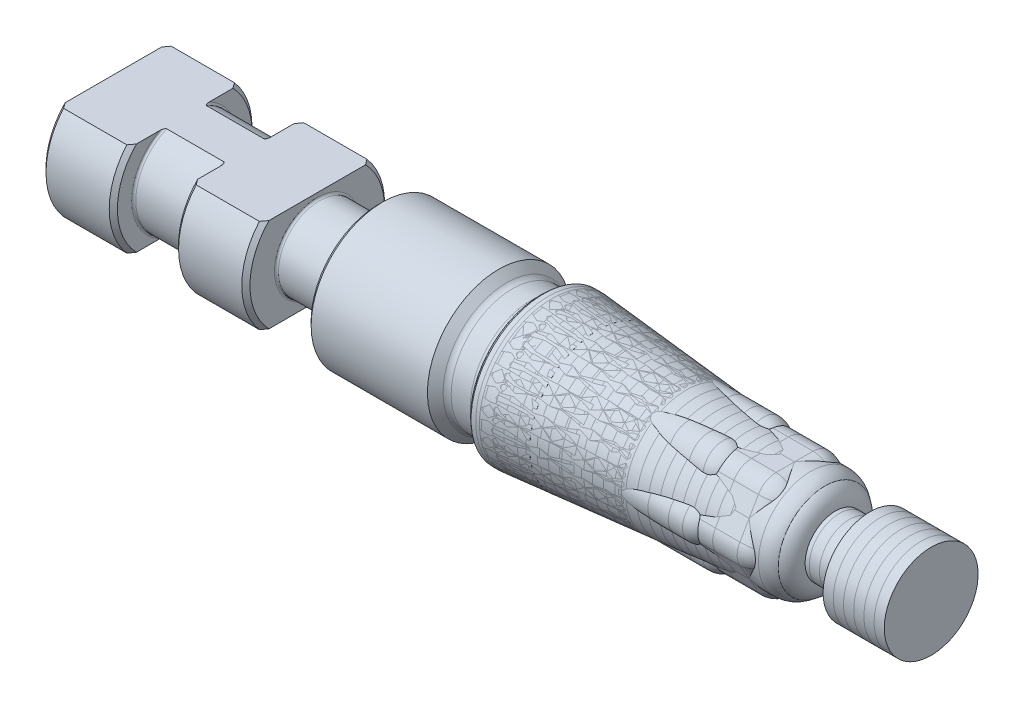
SolidWorks part; units mm, degrees
ref_plane "Front" through (0, 0, 0) normal (0, 0, 1) x (1, 0, 0)
ref_plane "Top" through (0, 0, 0) normal (0, 1, 0) x (1, 0, 0)
ref_plane "Right" through (0, 0, 0) normal (1, 0, 0) x (0, 0, -1)
sketch "Эскиз1" plane through (0, 0, 0) normal (0, 0, 1) x (1, 0, 0)
  line L0 (0, 0) -> (79097.9767, 0) construction
  line L1 (0, 0) -> (0, 1.75)
  line L2 (10.45, 1.65) -> (10.45, 1.5)
  line L3 (9.45, 1.75) -> (9.7, 1.5)
  line L4 (9.7, 1.5) -> (10.45, 1.5)
  line L6 (10.55, 1.75) -> (11.05, 1.75)
  line L7 (11.05, 1.75) -> (17.25, 1.2076)
  line L8 (17.5, 0.9576) -> (17.5, 0)
  line L9 (17.5, 0) -> (0, 0)
  line L10 (17.25, 1.2076) -> (17.5, 0.9576)
  line L11 (17.5, 0.9576) -> (17.5, 1.1857) construction
  line L12 (17.5, 1.1857) -> (17.25, 1.2076) construction
  line L13 (0, 1.75) -> (9.45, 1.75)
  arc A0 (10.55, 1.75) -> (10.45, 1.65) centre (10.55, 1.65) ccw
  dimension "D2" = 17.5
  dimension "D8" = 1
  dimension "D6" = 0.1
  dimension "D5" = 45
  dimension "D3" = 3.5
  dimension "D4" = 7.05
  dimension "D7" = 3
  dimension "D9" = 3.5
  dimension "D11" = 6.45
  dimension "D13" = 5
  dimension "D14" = 45
  dimension "D15" = 0.25
  dimension "D17" = 2.3714
revolve "Повернуть1" add sketch "Эскиз1" angle 360 about L0
sketch "Эскиз8" plane through (0, 0, 0) normal (0, 0, 1) x (1, 0, 0)
  line L0 (0, 0) -> (-50000, 0) construction
  line L2 (17.5, -0.9576) -> (17.5, 0.9576) construction
  line L3 (14.4002, 1.279) -> (14.6, 1.4394)
  line L4 (14.1266, 1.3009) -> (13.95, 1.4963)
  line L5 (13.95, 1.4963) -> (14.6, 1.4394)
  line L6 (17.25, 1.2076) -> (11.05, 1.75) construction
  arc A0 (14.1266, 1.3009) -> (14.4002, 1.279) centre (14.275, 1.435) ccw
  point P3 (14.275, 1.4678)
  point P10 (14.275, 1.235)
  dimension "D4" = 0.2
  dimension "D1" = 2.9
  dimension "D2" = 3.55
  dimension "D3" = 2.47
revolve "Вырез-Повернуть3" cut sketch "Эскиз8" angle 360 about L0
sketch "Эскиз13" plane through (17.5, 0, 0) normal (1, 0, 0) x (0, 0, -1)
  line L1 (-1.4491, 0) -> (-0.7246, -1.255)
  line L2 (-0.7246, -1.255) -> (0.7246, -1.255)
  line L3 (0.7246, -1.255) -> (1.4491, 0)
  line L4 (1.4491, 0) -> (0.7246, 1.255)
  line L5 (0.7246, 1.255) -> (-0.7246, 1.255)
  line L6 (-0.7246, 1.255) -> (-1.4491, 0)
  circle A0 centre (0, 0) radius 1.255 construction
  dimension "D1" = 2.51
extrude "Вырез-Вытянуть1" cut sketch "Эскиз13" against normal blind 3.3 flip side to cut
sketch "Эскиз7" plane through (0, 0, 0) normal (0, 0, 1) x (1, 0, 0)
  line L0 (0, 0) -> (-50000, 0) construction
  line L1 (12.8846, 1.5895) -> (12.9559, 1.4555)
  line L2 (13.95, 1.4963) -> (11.05, 1.75) construction
  line L3 (13.0424, 1.4525) -> (13.1154, 1.5693)
  line L4 (13.95, 1.4963) -> (11.05, 1.75) construction
  line L5 (13.1154, 1.5693) -> (12.8846, 1.5895)
  line L6 (17.5, -0.9576) -> (17.5, 0.9576) construction
  line L7 (11.8846, 1.677) -> (11.9559, 1.543)
  line L8 (12.0424, 1.5399) -> (12.1154, 1.6568)
  line L9 (12.1154, 1.6568) -> (11.8846, 1.677)
  arc A0 (13.0424, 1.4525) -> (12.9559, 1.4555) centre (13, 1.4789) cw
  arc A1 (12.0424, 1.5399) -> (11.9559, 1.543) centre (12, 1.5664) cw
  point P12 (13, 1.5794)
  point P13 (12.9983, 1.429)
  point P23 (12, 1.6669)
  point P24 (11.9983, 1.5165)
  dimension "D1" = 0.05
  dimension "D2" = 60
  dimension "D3" = 0.15
  dimension "D4" = 4.5
  dimension "D6" = 1
  dimension "D5" = 2
revolve "Вырез-Повернуть2" cut sketch "Эскиз7" angle 360 about L0
sketch "Эскиз9" plane through (0, 0, 0) normal (0, 0, 1) x (1, 0, 0)
  line L0 (0, 0) -> (-50000, 0) construction
  line L1 (17.5, 0) -> (17.5, 0.75)
  line L2 (17.5, -0.9576) -> (17.5, 0.9576) construction
  line L3 (17.5, 0.75) -> (17.3, 0.55)
  line L4 (17.3, 0.55) -> (15.5, 0.55)
  line L5 (15.5, 0.55) -> (15.1825, 0)
  line L6 (15.1825, 0) -> (17.5, 0)
  dimension "D1" = 60
  dimension "D2" = 45
  dimension "D3" = 1.5
  dimension "D4" = 1.1
  dimension "D5" = 2
revolve "Вырез-Повернуть4" cut sketch "Эскиз9" angle 360 about L0
fillet "Скругление1" radius 0.2 2 edges at (9.7, 0, 1.5) (10.45, 0, 1.5)
sketch "Эскиз14" plane through (0, 0, 0) normal (0, 0, 1) x (1, 0, 0)
  line L0 (9.45, 1.75) -> (0, 1.75) construction
  line L1 (5, 1.75) -> (6.5, 1.75)
  line L2 (5, 1.75) -> (5, 1)
  line L3 (5, 1) -> (6.5, 1)
  line L4 (6.5, 1.75) -> (6.5, 1)
  line L5 (0, 0) -> (-50000, 0) construction
  line L7 (1.75, 1.75) -> (3.25, 1.75)
  line L8 (1.75, 1.75) -> (1.75, 1.25)
  line L9 (1.75, 1.25) -> (3.25, 1.25)
  line L10 (3.25, 1.75) -> (3.25, 1.25)
  dimension "D1" = 6.5
  dimension "D2" = 1.5
  dimension "D3" = 2
  dimension "D4" = 1.75
  dimension "D5" = 2.5
revolve "Вырез-Повернуть5" cut sketch "Эскиз14" angle 360 about L5
fillet "Скругление2" radius 0.05 4 edges at (1.75, 0, -1.25) (3.25, 0, -1.25) (5, 0, -1) (6.5, 0, -1)
chamfer "Фаска3" distance 0.1 angle 45 5 edges at (0, 0, 1.75) (1.75, 0, -1.75) (3.25, 0, -1.75) (5, 0, -1.75) (6.5, 0, -1.75)
sketch "Эскиз15" plane through (0, 0, 0) normal (0, 0, 1) x (1, 0, 0)
  line L0 (0, 1.65) -> (0, -1.65) construction
  line L1 (0, 1.15) -> (6.5, 1.15)
  line L2 (0, 1.15) -> (0, 1.75)
  line L3 (0, 1.75) -> (6.5, 1.75)
  line L4 (6.5, 1.15) -> (6.5, 1.75)
  line L5 (6.5, 1.65) -> (6.5, -1.65) construction
  line L6 (4.9, 1.75) -> (3.35, 1.75) construction
  line L7 (0, 0) -> (-50000, 0) construction
  line L8 (6.5, -1.15) -> (6.5, -1.75)
  line L9 (0, -1.75) -> (6.5, -1.75)
  line L10 (0, -1.15) -> (0, -1.75)
  line L11 (0, -1.15) -> (6.5, -1.15)
  dimension "D1" = 2.3
extrude "Вырез-Вытянуть2" cut sketch "Эскиз15" against normal through all both and the other way through all
sketch "Эскиз16" plane through (0, 0, 0) normal (0, 0, 1) x (1, 0, 0)
  line L0 (0, 0) -> (-50000, 0) construction
  line L1 (0, 0) -> (0, 1)
  line L2 (0, 1.15) -> (0, -1.15) construction
  line L3 (0, 1) -> (0.2, 0.8)
  line L4 (0.2, 0.8) -> (4.5, 0.8)
  line L5 (4.5, 0.8) -> (4.9619, 0)
  line L6 (4.9619, 0) -> (0, 0)
  dimension "D1" = 60
  dimension "D2" = 1.6
  dimension "D3" = 4.5
  dimension "D4" = 45
  dimension "D5" = 2
revolve "Вырез-Повернуть6" cut sketch "Эскиз16" angle 360 about L0
sketch "Эскиз17" plane through (0, 0, 0) normal (0, 0, 1) x (1, 0, 0)
  line L0 (9.45, 1.75) -> (9.45, -1.75) construction
  point P0 (9.45, 0)
sketch "Эскиз18" plane through (0, 0, 0) normal (0, 0, 1) x (1, 0, 0)
  line L0 (0, 0) -> (-50000, 0) construction
  line L1 (10.55, 1.78) -> (10.6634, 1.78)
  line L2 (10.7506, 1.7762) -> (13.95, 1.4963)
  line L3 (14.4064, 0.9982) -> (14.4064, 0)
  line L4 (14.4064, 0) -> (10.55, 0)
  line L5 (10.55, 1.75) -> (10.55, -1.75) construction
  line L7 (13.95, 1.4963) -> (13.1154, 1.5693) construction
  line L8 (11.05, 1.75) -> (10.55, 1.75) construction
  line L10 (13.95, 1.4963) -> (13.95, -1.4963) construction
  line L11 (10.55, 1.78) -> (10.55, 0)
  arc A0 (13.95, 1.4963) -> (14.4064, 0.9982) centre (13.9064, 0.9982) cw
  arc A1 (10.7506, 1.7762) -> (10.6634, 1.78) centre (10.6634, 0.78) ccw
  dimension "D2" = 0.5
  dimension "D3" = 1
  dimension "D1" = 0.03
  dimension "D4" = 0
revolve "Повернуть2" add sketch "Эскиз18" angle 360 about L0
ref_plane "Плоскость16" through (13.95, 0, 0) normal (1, 0, 0) x (0, 0, -1)
sketch "Эскиз21" plane through (13.95, 0, 0) normal (1, 0, 0) x (0, 0, -1)
  line L0 (-0.7419, 1.285) -> (0.7419, 1.285)
  line L1 (0.7419, 1.285) -> (1.4838, 0)
  line L2 (1.4838, 0) -> (0.7419, -1.285)
  line L3 (0.7419, -1.285) -> (-0.7419, -1.285)
  line L4 (-0.7419, -1.285) -> (-1.4838, 0)
  line L5 (-1.4838, 0) -> (-0.7419, 1.285)
  circle A0 centre (0, 0) radius 1.285 construction
  point P5 (0, 1.285)
  point P18 (0, 0)
  point P35 (0, 0)
  dimension "D2" = 2.57
  dimension "D1" = 6
extrude "Бобышка-Вытянуть1" add sketch "Эскиз21" along normal blind 3.25
fillet "Скругление3" radius 0.5 6 edges at (17.2, -1.285, 0) (17.2, -0.6425, 1.1128) (17.2, 0.6425, 1.1128) (17.2, 1.285, 0) (17.2, 0.6425, -1.1128) (17.2, -0.6425, -1.1128)
fillet "Скругление4" radius 0.5 12 edges at (15.3628, 0, 1.4838) (15.3628, 1.285, 0.7419) (15.3628, 1.285, -0.7419) (15.3628, 0, -1.4838) (15.3628, -1.285, 0.7419) (15.3628, -1.285, -0.7419) (17.0536, 0, 1.3147) (17.0536, 1.1386, 0.6573) (17.0536, 1.1386, -0.6573) (17.0536, 0, -1.3147) (17.0536, -1.1386, 0.6573) (17.0536, -1.1386, -0.6573)
sketch "Эскиз23" plane through (0, 0, 0) normal (0, 0, 1) x (1, 0, 0)
  line L0 (0, 0) -> (-50000, 0) construction
  line L1 (16.7, 1.285) -> (17.1, 1.285)
  line L3 (17.6, 0.785) -> (17.6, 0)
  line L4 (17.6, 0) -> (16.7, 0)
  line L6 (16.7, 0) -> (16.7, 1.285)
  line L7 (17.5, -0.9576) -> (17.5, 0.9576) construction
  arc A0 (17.1, 1.285) -> (17.6, 0.785) centre (17.1, 0.785) cw
  dimension "D1" = 0.5
  dimension "D3" = 0.1
revolve "Повернуть3" add sketch "Эскиз23" angle 360 about L0
sketch "Эскиз25" plane through (0, 0, 0) normal (0, 1, 0) x (1, 0, 0)
  line L0 (0, 0) -> (-50000, 0) construction
  line L1 (13.95, 0.9963) -> (13.95, 1.4963)
  line L2 (13.95, 1.4963) -> (13.95, -1.4963) construction
  line L3 (13.95, 1.4963) -> (15.45, 1.4963)
  line L4 (15.95, 0.9963) -> (13.95, 0.9963)
  line L5 (14.45, 0.9963) -> (50014.45, 0.9963) construction
  arc A0 (15.45, 1.4963) -> (15.95, 0.9963) centre (15.45, 0.9963) cw
  dimension "D1" = 0.5
  dimension "D2" = 1.5
revolve "Повернуть4" add sketch "Эскиз25" angle 360 about L5
pattern_circular "Круговой массив1" count 6 over 360 about axis through (0, 0, 0) along (1, 0, 0) of "Повернуть4"
sketch "Эскиз24" plane through (17.6, 0, 0) normal (1, 0, 0) x (0, 0, -1)
  circle A0 centre (0, 0) radius 0.7
  dimension "D1" = 1.4
ref_plane "Плоскость31" through (17.1, 0, 0) normal (1, 0, 0) x (0, 0, -1)
ref_plane "Плоскость32" through (16.6, 0, 0) normal (1, 0, 0) x (0, 0, -1)
ref_plane "Плоскость33" through (16.1, 0, 0) normal (1, 0, 0) x (0, 0, -1)
ref_plane "Плоскость34" through (15.6, 0, 0) normal (1, 0, 0) x (0, 0, -1)
ref_plane "Плоскость35" through (15.1, 0, 0) normal (1, 0, 0) x (0, 0, -1)
ref_plane "Плоскость36" through (14.6, 0, 0) normal (1, 0, 0) x (0, 0, -1)
ref_plane "Плоскость37" through (14.1, 0, 0) normal (1, 0, 0) x (0, 0, -1)
ref_plane "Плоскость38" through (13.6, 0, 0) normal (1, 0, 0) x (0, 0, -1)
ref_plane "Плоскость39" through (13.1, 0, 0) normal (1, 0, 0) x (0, 0, -1)
ref_plane "Плоскость40" through (12.6, 0, 0) normal (1, 0, 0) x (0, 0, -1)
ref_plane "Плоскость41" through (12.1, 0, 0) normal (1, 0, 0) x (0, 0, -1)
ref_plane "Плоскость42" through (11.6, 0, 0) normal (1, 0, 0) x (0, 0, -1)
ref_plane "Плоскость43" through (11.1, 0, 0) normal (1, 0, 0) x (0, 0, -1)
ref_plane "Плоскость44" through (0, 0, 0) normal (0, 0, 1) x (1, 0, 0)
ref_plane "Плоскость45" through (0, 0, 0) normal (0, 1, 0) x (1, 0, 0)
ref_plane "Плоскость46" through (0, 0, 0) normal (0, -0.866, -0.5) x (-1, 0, 0)
ref_plane "Плоскость47" through (0, 0, 0) normal (0, -0.866, 0.5) x (-1, 0, 0)
sketch "Эскиз26" plane through (0, 0, 0) normal (0, 1, 0) x (1, 0, 0)
  line L0 (0, 0) -> (50000, 0) construction
  line L1 (17.6, 0) -> (17.6, 0.74)
  line L2 (17.6, 0) -> (17.6, 0.785) construction
  line L3 (17.6, 0.74) -> (18.55, 0.74)
  line L4 (18.55, 0.74) -> (18.55, 1.15)
  line L5 (18.55, 1.15) -> (20.05, 1.15)
  line L6 (20.05, 1.15) -> (20.05, 0)
  line L7 (20.05, 0) -> (17.6, 0)
  line L8 (17.6, 0) -> (17.6001, -0.0048)
  dimension "D1" = 1.48
  dimension "D2" = 0.95
  dimension "D3" = 1.5
  dimension "D4" = 2.3
revolve "Повернуть5" add sketch "Эскиз26" angle 360 about L0
fillet "Скругление5" radius 0.15 1 edges at (18.55, 0, 0.74)
ref_plane "Плоскость48" through (19.8, 0, 0) normal (1, 0, 0) x (0, 0, -1)
ref_plane "Плоскость49" through (19.55, 0, 0) normal (1, 0, 0) x (0, 0, -1)
ref_plane "Плоскость50" through (19.3, 0, 0) normal (1, 0, 0) x (0, 0, -1)
ref_plane "Плоскость51" through (19.05, 0, 0) normal (1, 0, 0) x (0, 0, -1)
ref_plane "Плоскость52" through (18.8, 0, 0) normal (1, 0, 0) x (0, 0, -1)
ref_plane "Плоскость53" through (18.55, 0, 0) normal (1, 0, 0) x (0, 0, -1)
ref_plane "Плоскость54" through (18.3, 0, 0) normal (1, 0, 0) x (0, 0, -1)
ref_plane "Плоскость55" through (18.05, 0, 0) normal (1, 0, 0) x (0, 0, -1)
ref_plane "Плоскость56" through (17.8, 0, 0) normal (1, 0, 0) x (0, 0, -1)
sketch "Эскиз27" plane through (0, 0, 0) normal (0, 0, 1) x (1, 0, 0)
  line L0 (0, 0) -> (-50000, 0) construction
  line L1 (0, 1.15) -> (0, -1.15) construction
  line L2 (10.55, 0) -> (10.55, 1.78)
  line L3 (10.55, 1.75) -> (10.55, -1.75) construction
  line L4 (10.55, 1.78) -> (10.6634, 1.78)
  line L5 (10.7506, 1.7762) -> (17.2445, 1.2081)
  line L6 (11.8846, 1.677) -> (11.05, 1.75) construction
  line L7 (17.7, 0.74) -> (17.7, 0)
  line L8 (17.7, 0.74) -> (18.55, 0.74)
  line L9 (18.55, 0.74) -> (18.55, 1.15)
  line L10 (18.55, 1.15) -> (20.05, 1.15)
  line L11 (20.05, 1.15) -> (20.05, 0)
  line L12 (20.05, 0) -> (10.55, 0)
  line L13 (11.05, 1.75) -> (10.55, 1.75) construction
  line L14 (12.8846, 1.5895) -> (12.1154, 1.6568) construction
  line L16 (17.5, -0.9576) -> (17.5, 0.9576) construction
  arc A0 (10.6634, 1.78) -> (10.7506, 1.7762) centre (10.6634, 0.78) cw
  arc A1 (17.2445, 1.2081) -> (17.7, 0.74) centre (17.2009, 0.71) cw
  point P4 (0, 0)
  dimension "D2" = 1
  dimension "D4" = 0.5
  dimension "D1" = 0.03
  dimension "D3" = 0
  dimension "D5" = 0.2
  dimension "D6" = 1.48
  dimension "D7" = 1.05
  dimension "D8" = 2.3
  dimension "D9" = 1.5
revolve "Повернуть6" add sketch "Эскиз27" angle 360 about L0
fillet "Скругление6" radius 0.15
ref_plane "Плоскость57" through (19.8, 0, 0) normal (1, 0, 0) x (0, 0, -1)
ref_plane "Плоскость58" through (19.55, 0, 0) normal (1, 0, 0) x (0, 0, -1)
ref_plane "Плоскость59" through (19.3, 0, 0) normal (1, 0, 0) x (0, 0, -1)
ref_plane "Плоскость60" through (19.05, 0, 0) normal (1, 0, 0) x (0, 0, -1)
ref_plane "Плоскость61" through (18.8, 0, 0) normal (1, 0, 0) x (0, 0, -1)
ref_plane "Плоскость62" through (18.55, 0, 0) normal (1, 0, 0) x (0, 0, -1)
ref_plane "Плоскость63" through (18.3, 0, 0) normal (1, 0, 0) x (0, 0, -1)
ref_plane "Плоскость64" through (18.05, 0, 0) normal (1, 0, 0) x (0, 0, -1)
ref_plane "Плоскость65" through (17.8, 0, 0) normal (1, 0, 0) x (0, 0, -1)
ref_plane "Плоскость66" through (17.55, 0, 0) normal (1, 0, 0) x (0, 0, -1)
ref_plane "Плоскость67" through (17.3, 0, 0) normal (1, 0, 0) x (0, 0, -1)
ref_plane "Плоскость68" through (17.05, 0, 0) normal (1, 0, 0) x (0, 0, -1)
ref_plane "Плоскость69" through (16.8, 0, 0) normal (1, 0, 0) x (0, 0, -1)
ref_plane "Плоскость70" through (16.55, 0, 0) normal (1, 0, 0) x (0, 0, -1)
ref_plane "Плоскость71" through (16.3, 0, 0) normal (1, 0, 0) x (0, 0, -1)
ref_plane "Плоскость72" through (16.05, 0, 0) normal (1, 0, 0) x (0, 0, -1)
ref_plane "Плоскость73" through (15.8, 0, 0) normal (1, 0, 0) x (0, 0, -1)
ref_plane "Плоскость74" through (15.55, 0, 0) normal (1, 0, 0) x (0, 0, -1)
ref_plane "Плоскость75" through (15.3, 0, 0) normal (1, 0, 0) x (0, 0, -1)
ref_plane "Плоскость76" through (15.05, 0, 0) normal (1, 0, 0) x (0, 0, -1)
ref_plane "Плоскость77" through (14.8, 0, 0) normal (1, 0, 0) x (0, 0, -1)
ref_plane "Плоскость78" through (14.55, 0, 0) normal (1, 0, 0) x (0, 0, -1)
ref_plane "Плоскость79" through (14.3, 0, 0) normal (1, 0, 0) x (0, 0, -1)
ref_plane "Плоскость80" through (14.05, 0, 0) normal (1, 0, 0) x (0, 0, -1)
ref_plane "Плоскость81" through (13.8, 0, 0) normal (1, 0, 0) x (0, 0, -1)
ref_plane "Плоскость82" through (13.55, 0, 0) normal (1, 0, 0) x (0, 0, -1)
ref_plane "Плоскость83" through (13.3, 0, 0) normal (1, 0, 0) x (0, 0, -1)
ref_plane "Плоскость84" through (13.05, 0, 0) normal (1, 0, 0) x (0, 0, -1)
ref_plane "Плоскость85" through (12.8, 0, 0) normal (1, 0, 0) x (0, 0, -1)
ref_plane "Плоскость86" through (12.55, 0, 0) normal (1, 0, 0) x (0, 0, -1)
ref_plane "Плоскость87" through (12.3, 0, 0) normal (1, 0, 0) x (0, 0, -1)
ref_plane "Плоскость88" through (12.05, 0, 0) normal (1, 0, 0) x (0, 0, -1)
ref_plane "Плоскость89" through (11.8, 0, 0) normal (1, 0, 0) x (0, 0, -1)
ref_plane "Плоскость90" through (11.55, 0, 0) normal (1, 0, 0) x (0, 0, -1)
ref_plane "Плоскость91" through (11.3, 0, 0) normal (1, 0, 0) x (0, 0, -1)
ref_plane "Плоскость92" through (11.05, 0, 0) normal (1, 0, 0) x (0, 0, -1)
ref_plane "Плоскость93" through (10.8, 0, 0) normal (1, 0, 0) x (0, 0, -1)
